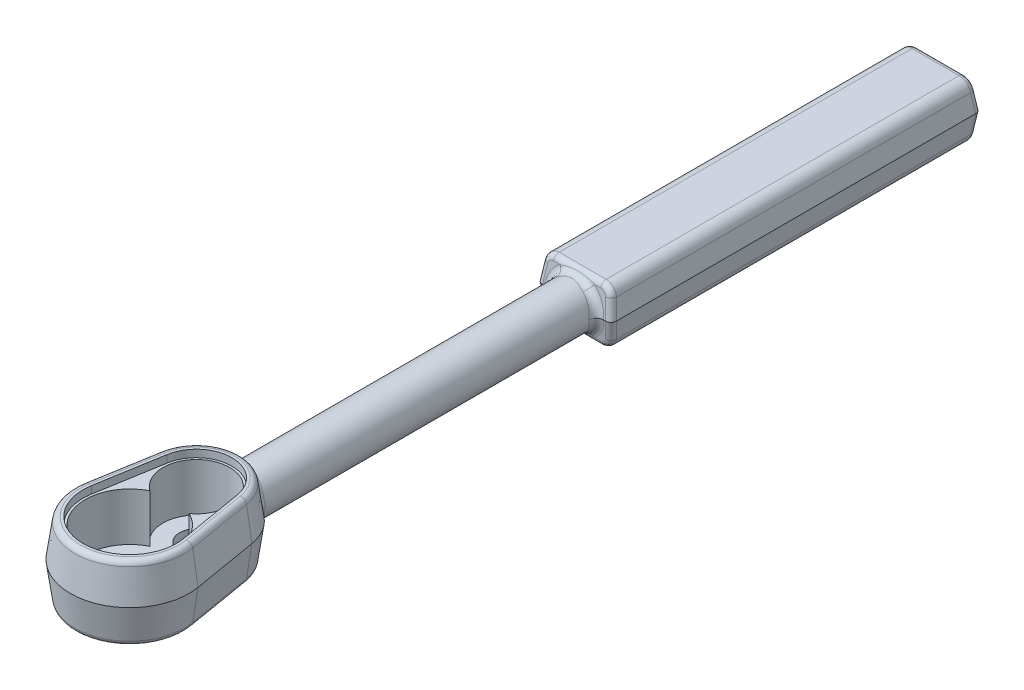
SolidWorks part; units mm, degrees
ref_plane "Front" through (0, 0, 0) normal (0, 0, 1) x (1, 0, 0)
ref_plane "Top" through (0, 0, 0) normal (0, 1, 0) x (1, 0, 0)
ref_plane "Right" through (0, 0, 0) normal (1, 0, 0) x (0, 0, -1)
sketch "Sketch1" plane through (0, 0, 0) normal (0, 1, 0) x (1, 0, 0)
  line L0 (0, 0) -> (0, 220) construction
  line L1 (10, 120) -> (10, 220)
  line L2 (-10, 120) -> (-10, 220)
  line L3 (10, 220) -> (-10, 220)
  line L4 (10, 120) -> (-10, 120)
  point P8 (0, 120)
  dimension "D1" = 220
  dimension "D2" = 100
  dimension "D3" = 20
extrude "Handle" add sketch "Sketch1" along normal mid plane 15 draft 8
sketch "Sketch2" plane through (0, 0, 0) normal (0, 0, 1) x (1, 0, 0)
  circle A0 centre (0, 0) radius 6
  dimension "D1" = 12
extrude "Transition" add sketch "Sketch2" against normal up to next
sketch "Sketch3" plane through (0, 0, 0) normal (0, 1, 0) x (1, 0, 0)
  line L0 (-15.7762, 2.6667) -> (-12.8182, 20.1667)
  line L1 (12.8182, 20.1667) -> (15.7762, 2.6667)
  line L2 (0, 0) -> (0, 220) construction
  arc A0 (-12.8182, 20.1667) -> (12.8182, 20.1667) centre (0, 18) cw
  arc A1 (15.7762, 2.6667) -> (-15.7762, 2.6667) centre (0, 0) cw
  dimension "D1" = 13
  dimension "D2" = 16
  dimension "D3" = 18
  dimension "D4" = 19.188
extrude "Head" add sketch "Sketch3" along normal mid plane 20
sketch "Sketch4" plane through (0, 10, 0) normal (0, 1, 0) x (-1, 0, 0)
  line L4 (-12.4184, -2.0991) -> (-9.4604, -19.5991)
  line L5 (9.4604, -19.5991) -> (12.4184, -2.0991)
  line L6 (-12.4184, -2.0991) -> (-9.4604, -19.5991)
  line L7 (9.4604, -19.5991) -> (12.4184, -2.0991)
  arc A4 (12.4184, -2.0991) -> (-12.4184, -2.0991) centre (0, 0) ccw
  arc A5 (-9.4604, -19.5991) -> (9.4604, -19.5991) centre (0, -18) ccw
  arc A6 (12.4184, -2.0991) -> (-12.4184, -2.0991) centre (0, 0) ccw
  arc A7 (-9.4604, -19.5991) -> (9.4604, -19.5991) centre (0, -18) ccw
  dimension "D1" = 2
extrude "Recess" cut sketch "Sketch4" against normal blind 2
sketch "Sketch5" plane through (0, 8, 0) normal (0, 1, 0) x (-1, 0, 0)
  arc A0 (5.3327, -10.75) -> (-5.3327, -10.75) centre (0, 0) ccw
  arc A1 (-5.3327, -10.75) -> (5.3327, -10.75) centre (0, -18) ccw
  dimension "D1" = 18
  dimension "D2" = 24
extrude "pocket" cut sketch "Sketch5" against normal blind 13
sketch "Sketch6" plane through (0, -5, 0) normal (0, 1, 0) x (-1, 0, 0)
  circle A0 centre (0, -18) radius 4.5
  dimension "D1" = 9
extrude "Wheel Hole" cut sketch "Sketch6" against normal through all
sketch "Sketch7" plane through (-4.1519, -5, 12.7131) normal (0, 1, 0) x (-1, 0, 0)
  circle A0 centre (-4.1519, -12.7131) radius 6
  arc A1 (1.1808, -23.4631) -> (-9.4846, -23.4631) centre (-4.1519, -12.7131) ccw construction
  dimension "D1" = 12
extrude "Ratchet Hole" cut sketch "Sketch7" against normal through all
fillet "Handle Fillets" radius 3 4 edges at (-8.9459, -7.5, -170) (-8.9459, 7.5, -170) (8.9459, -7.5, -170) (8.9459, 7.5, -170)
fillet "H End Fillets" radius 1.5 28 edges at (0, 10, 14.5946) (12.9114, 10, -11.1824) (0, 10, -29.5946) (-12.9114, 10, -11.1824) (0, -10, 14.5946) (-12.9114, -10, -11.1824) (0, -10, -29.5946) (12.9114, -10, -11.1824) (0, 7.5, -121.0541) (0, 7.5, -218.9459) (-9.6544, 2.4588, -219.6544) (9.6544, 2.4588, -219.6544) (-8.3063, 6.7641, -219.0494) (8.3063, 6.7641, -219.0494) (9.6544, 2.4588, -120.3456) (-9.6544, 2.4588, -120.3456) (-8.3063, 6.7641, -120.9506) (8.3063, 6.7641, -120.9506) (9.6544, -2.4588, -120.3456) (9.6544, -2.4588, -219.6544) (0, -7.5, -218.9459) (-9.6544, -2.4588, -219.6544) (-8.3063, -6.7641, -219.0494) (8.3063, -6.7641, -219.0494) (0, -7.5, -121.0541) (-9.6544, -2.4588, -120.3456) (-8.3063, -6.7641, -120.9506) (8.3063, -6.7641, -120.9506)
fillet "T-H Fillets" radius 2 4 edges at (0, 6, -120.8432) (0, -6, -120.8432) (0.1675, -5.9977, -30.1559) (0.1675, 5.9977, -30.1559)
